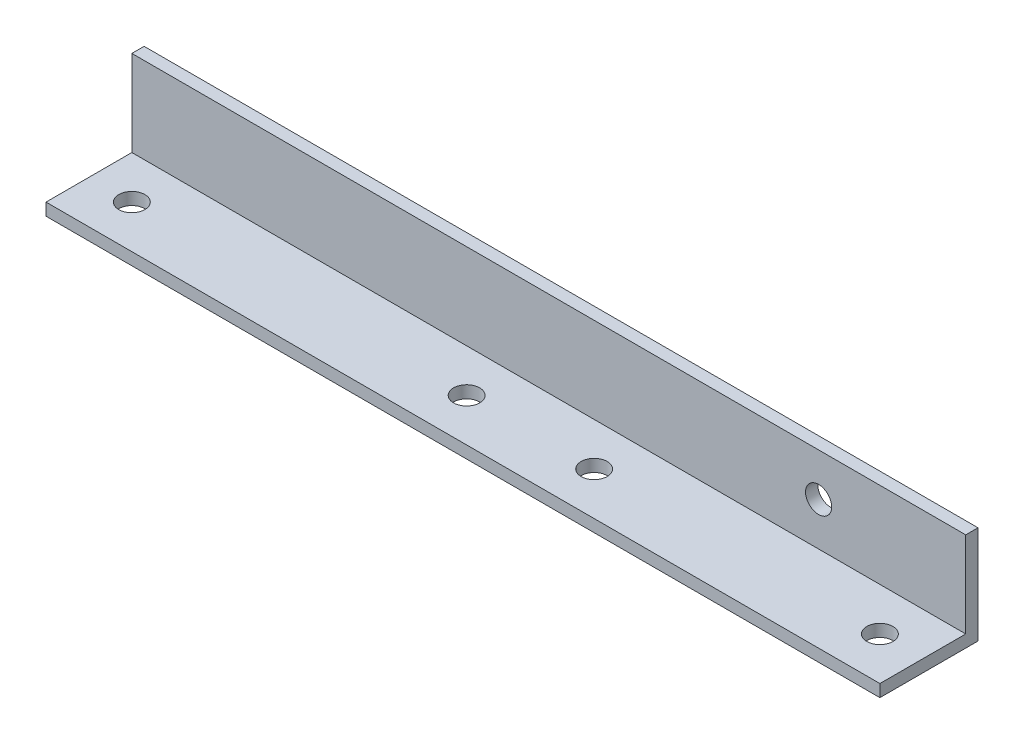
SolidWorks part; units mm, degrees
ref_plane "Front Plane" through (0, 0, 0) normal (0, 0, 1) x (1, 0, 0)
ref_plane "Top Plane" through (0, 0, 0) normal (0, 1, 0) x (1, 0, 0)
ref_plane "Right Plane" through (0, 0, 0) normal (1, 0, 0) x (0, 0, -1)
sketch "Sketch1" plane through (0, 0, 0) normal (0, 1, 0) x (1, 0, 0)
  line L1 (-107.95, 12.7) -> (107.95, 12.7)
  line L2 (-107.95, 12.7) -> (-107.95, -12.7)
  line L3 (-107.95, -12.7) -> (107.95, -12.7)
  line L4 (107.95, 12.7) -> (107.95, -12.7)
  line L5 (-107.95, 12.7) -> (107.95, -12.7) construction
  line L6 (-107.95, -12.7) -> (107.95, 12.7) construction
  point P0 (0, 0)
  dimension "D1" = 215.9
  dimension "D2" = 25.4
extrude "Boss-Extrude1" add sketch "Sketch1" along normal blind 3.175
sketch "Sketch2" plane through (0, 3.175, 0) normal (0, 1, 0) x (1, 0, 0)
  line L0 (-107.95, 12.7) -> (-107.95, 9.525)
  line L1 (-107.95, 12.7) -> (-107.95, -12.7) construction
  line L2 (-107.95, 9.525) -> (107.95, 9.525)
  line L3 (107.95, -12.7) -> (107.95, 12.7) construction
  line L4 (107.95, 9.525) -> (107.95, 12.7)
  line L5 (107.95, 12.7) -> (-107.95, 12.7)
  dimension "D1" = 3.175
extrude "Boss-Extrude2" add sketch "Sketch2" along normal blind 22.225
sketch "Sketch3" plane through (0, 3.175, 0) normal (0, 1, 0) x (1, 0, 0)
  line L0 (-107.95, -1.5875) -> (107.95, -1.5875) construction
  line L1 (-107.95, 9.525) -> (-107.95, -12.7) construction
  line L2 (107.95, -12.7) -> (107.95, 9.525) construction
  line L3 (-107.95, -12.7) -> (107.95, -12.7) construction
  circle A0 centre (-96.8375, -1.5875) radius 3.3782
  circle A1 centre (-10.16, -1.5875) radius 3.3782
  circle A2 centre (96.8375, -1.5875) radius 3.3782
  circle A3 centre (22.86, -1.5875) radius 3.3782
  dimension "D2" = 6.7564
  dimension "D3" = 6.7564
  dimension "D4" = 6.7564
  dimension "D5" = 6.7564
  dimension "D7" = 86.6775
  dimension "D1" = 11.1125
  dimension "D6" = 11.1125
  dimension "D8" = 11.1125
  dimension "D9" = 33.02
extrude "Cut-Extrude1" cut sketch "Sketch3" against normal through all
sketch "Sketch4" plane through (0, 0, -9.525) normal (0, 0, 1) x (1, 0, 0)
  line L0 (-107.95, 14.2875) -> (107.95, 14.2875) construction
  line L1 (-107.95, 25.4) -> (-107.95, 3.175) construction
  line L2 (107.95, 25.4) -> (107.95, 3.175) construction
  line L3 (-107.95, 25.4) -> (107.95, 25.4) construction
  circle A0 centre (69.85, 14.2875) radius 3.3782
  dimension "D2" = 6.7564
  dimension "D1" = 11.1125
  dimension "D3" = 38.1
extrude "Cut-Extrude2" cut sketch "Sketch4" against normal through all
